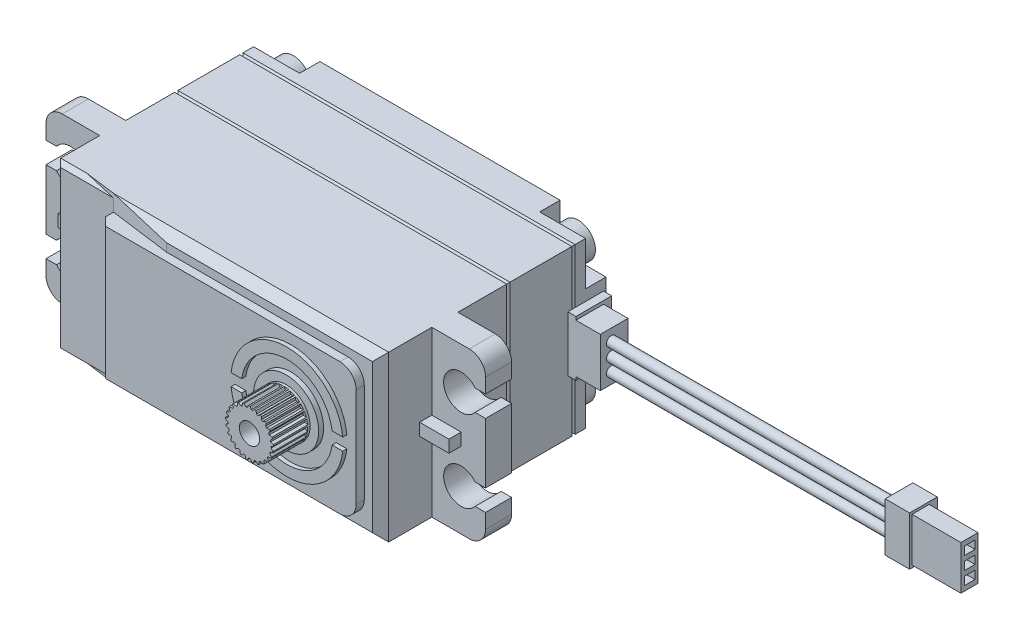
SolidWorks part; units mm, degrees
ref_plane "前视基准面" through (0, 0, 0) normal (0, 0, 1) x (1, 0, 0)
ref_plane "上视基准面" through (0, 0, 0) normal (0, 1, 0) x (1, 0, 0)
ref_plane "右视基准面" through (0, 0, 0) normal (1, 0, 0) x (0, 0, -1)
sketch "草图1" plane through (0, 0, 0) normal (0, 0, 1) x (1, 0, 0)
  line L1 (-20.4, 10.1) -> (20.4, 10.1)
  line L2 (-20.4, 10.1) -> (-20.4, -10.1)
  line L3 (-20.4, -10.1) -> (20.4, -10.1)
  line L4 (20.4, 10.1) -> (20.4, -10.1)
  dimension "D1" = 20.4
  dimension "D2" = 40.8
  dimension "D3" = 10.1
  dimension "D4" = 20.2
extrude "凸台-拉伸1" add sketch "草图1" along normal blind 4
chamfer "倒角1" distance 0.2 angle 45 4 edges at (0, -10.1, 4) (20.4, 0, 4) (-20.4, 0, 4) (0, 10.1, 4)
sketch "草图2" plane through (0, 0, 4) normal (0, 0, 1) x (1, 0, 0)
  line L0 (20.4, 10.1) -> (20.4, -10.1) construction
  line L1 (20.4, -10.1) -> (-20.4, -10.1) construction
  line L2 (-20.4, -10.1) -> (-20.4, 10.1) construction
  line L3 (-20.4, 10.1) -> (20.4, 10.1) construction
  line L16 (20.4, 10.1) -> (20.4, -10.1)
  line L17 (20.4, -10.1) -> (-20.4, -10.1)
  line L18 (-20.4, -10.1) -> (-20.4, 10.1)
  line L19 (-20.4, 10.1) -> (20.4, 10.1)
extrude "凸台-拉伸2" add sketch "草图2" along normal blind 8 separate body
chamfer "倒角5" distance 0.2 angle 45 4 edges at (0, -10.1, 12) (20.4, 0, 12) (-20.4, 0, 12) (0, 10.1, 12)
sketch "草图3" plane through (0, 0, 12) normal (0, 0, 1) x (1, 0, 0)
  line L0 (20.4, 10.1) -> (20.4, -10.1) construction
  line L1 (20.4, -10.1) -> (-20.4, -10.1) construction
  line L2 (-20.4, -10.1) -> (-20.4, 10.1) construction
  line L3 (-20.4, 10.1) -> (20.4, 10.1) construction
  line L24 (20.4, 10.1) -> (20.4, -10.1)
  line L25 (20.4, -10.1) -> (-20.4, -10.1)
  line L26 (-20.4, -10.1) -> (-20.4, 10.1)
  line L27 (-20.4, 10.1) -> (20.4, 10.1)
extrude "凸台-拉伸3" add sketch "草图3" along normal blind 15.7 separate body
chamfer "倒角6" distance 0.2 angle 45 4 edges at (0, 10.1, 12) (20.4, 0, 12) (-20.4, 0, 12) (0, -10.1, 12)
chamfer "倒角3" distance 1 angle 45 4 edges at (20.4, 0, 27.7) (0, -10.1, 27.7) (-20.4, 0, 27.7) (0, 10.1, 27.7)
chamfer "倒角4" distance 0.2 angle 45 4 edges at (0, 10.1, 4) (20.4, 0, 4) (0, -10.1, 4) (-20.4, 0, 4)
sketch "草图4" plane through (0, 0, 27.7) normal (0, 0, 1) x (1, 0, 0)
  line L0 (20.4, 10.1) -> (20.4, -10.1) construction
  circle A0 centre (10.4, 0) radius 6.9
  dimension "D1" = 10
  dimension "D2" = 13.8
extrude "凸台-拉伸4" add sketch "草图4" along normal blind 1.5
sketch "草图5" plane through (0, 0, 29.2) normal (0, 0, 1) x (1, 0, 0)
  circle A0 centre (10.4, 0) radius 4
  dimension "D1" = 8
extrude "凸台-拉伸5" add sketch "草图5" along normal blind 0.1
sketch "草图6" plane through (0, 0, 29.3) normal (0, 0, 1) x (1, 0, 0)
  circle A0 centre (10.4, 0) radius 2.95
  dimension "D1" = 5.9
extrude "凸台-拉伸6" add sketch "草图6" along normal blind 4.5
sketch "草图7" plane through (0, 0, 33.8) normal (0, 0, 1) x (1, 0, 0)
  circle A0 centre (10.4, 0) radius 1.25
  dimension "D1" = 2.5
extrude "切除-拉伸1" cut sketch "草图7" against normal blind 5
sketch "草图8" plane through (0, 0, 33.8) normal (0, 0, 1) x (1, 0, 0)
  line L0 (11.0364, 2.8805) -> (10.8129, 2.6133)
  line L1 (10.3, 2.9483) -> (10.15, 2.6339)
  line L2 (10.4752, 2.949) -> (10.624, 2.6372)
  line L3 (11.7327, 2.6318) -> (11.4498, 2.4286)
  line L4 (11.2062, 2.8377) -> (11.2728, 2.4987)
  line L5 (12.3454, 2.2177) -> (12.0208, 2.0912)
  line L6 (11.8866, 2.548) -> (11.8667, 2.2031)
  line L7 (12.8358, 1.6642) -> (12.4899, 1.6224)
  line L8 (12.4736, 2.0983) -> (12.3686, 1.7691)
  line L9 (13.1731, 1.0062) -> (12.8277, 1.0517)
  line L10 (12.9302, 1.5167) -> (12.7467, 1.224)
  line L11 (13.3362, 0.2849) -> (13.013, 0.4149)
  line L12 (13.2279, 0.8398) -> (12.9773, 0.6019)
  line L13 (13.3148, -0.4542) -> (13.0341, -0.248)
  line L14 (13.3479, 0.1101) -> (13.0461, -0.0579)
  line L15 (13.1103, -1.1648) -> (12.8897, -0.8953)
  line L16 (13.2827, -0.6264) -> (12.9485, -0.7142)
  line L17 (12.7355, -1.8023) -> (12.5888, -1.4863)
  line L18 (13.0364, -1.3237) -> (12.6909, -1.3255)
  line L19 (12.2139, -2.3264) -> (12.1504, -1.9839)
  line L20 (12.6244, -1.9377) -> (12.2892, -1.8536)
  line L21 (11.5783, -2.7045) -> (11.6021, -2.3569)
  line L22 (12.0726, -2.43) -> (11.7689, -2.2652)
  line L23 (10.8687, -2.9125) -> (10.9781, -2.5818)
  line L24 (11.4157, -2.7696) -> (11.1626, -2.5345)
  line L25 (10.1297, -2.9376) -> (10.3179, -2.6445)
  line L26 (10.695, -2.9352) -> (10.5083, -2.6445)
  line L27 (9.4076, -2.7781) -> (9.6628, -2.541)
  line L28 (9.9558, -2.9164) -> (9.8473, -2.5883)
  line L29 (8.7479, -2.444) -> (9.0541, -2.2778)
  line L30 (9.2445, -2.7143) -> (9.2209, -2.3696)
  line L31 (8.192, -1.9564) -> (8.5299, -1.8716)
  line L32 (8.6058, -2.3416) -> (8.6687, -2.0019)
  line L33 (7.7749, -1.3458) -> (8.1232, -1.3477)
  line L34 (8.0798, -1.8219) -> (8.2252, -1.5085)
  line L35 (7.5227, -0.6507) -> (7.8596, -0.7391)
  line L36 (7.6996, -1.1876) -> (7.9184, -0.9202)
  line L37 (7.4512, 0.0853) -> (7.7556, -0.0841)
  line L38 (7.4891, -0.4787) -> (7.7675, -0.2742)
  line L39 (7.5651, 0.816) -> (7.8177, 0.5762)
  line L40 (7.4615, 0.2602) -> (7.7821, 0.3891)
  line L41 (7.8571, 1.4953) -> (8.0422, 1.2002)
  line L42 (7.6185, 0.9828) -> (7.9611, 1.0279)
  line L43 (8.3088, 2.0808) -> (8.4147, 1.7489)
  line L44 (7.9503, 1.6437) -> (8.2933, 1.6022)
  line L45 (8.892, 2.5354) -> (8.912, 2.1877)
  line L46 (8.436, 2.2012) -> (8.758, 2.0758)
  line L47 (9.5699, 2.8308) -> (9.5028, 2.489)
  line L48 (9.0452, 2.6205) -> (9.3258, 2.4189)
  line L49 (9.7394, 2.8751) -> (9.9611, 2.6101)
  circle A0 centre (10.4, 0) radius 2.95 construction
  arc A1 (11.0364, 2.8805) -> (10.4752, 2.949) centre (10.4, 0) ccw
  arc A2 (10.15, 2.6339) -> (9.9611, 2.6101) centre (10.4, -0.1047) ccw
  arc A3 (10.3, 2.9483) -> (9.7394, 2.8751) centre (10.4, 0) ccw
  arc A4 (10.8129, 2.6133) -> (10.624, 2.6372) centre (10.374, -0.1014) ccw
  arc A5 (11.7327, 2.6318) -> (11.2062, 2.8377) centre (10.4, 0) ccw
  arc A6 (11.4498, 2.4286) -> (11.2728, 2.4987) centre (10.3496, -0.0917) ccw
  arc A7 (12.3454, 2.2177) -> (11.8866, 2.548) centre (10.4, 0) ccw
  arc A8 (12.0208, 2.0912) -> (11.8667, 2.2031) centre (10.3283, -0.0763) ccw
  arc A9 (12.8358, 1.6642) -> (12.4736, 2.0983) centre (10.4, 0) ccw
  arc A10 (12.4899, 1.6224) -> (12.3686, 1.7691) centre (10.3116, -0.0561) ccw
  arc A11 (13.1731, 1.0062) -> (12.9302, 1.5167) centre (10.4, 0) ccw
  arc A12 (12.8277, 1.0517) -> (12.7467, 1.224) centre (10.3004, -0.0324) ccw
  arc A13 (13.3362, 0.2849) -> (13.2279, 0.8398) centre (10.4, 0) ccw
  arc A14 (13.013, 0.4149) -> (12.9773, 0.6019) centre (10.2955, -0.0066) ccw
  arc A15 (13.3148, -0.4542) -> (13.3479, 0.1101) centre (10.4, 0) ccw
  arc A16 (13.0341, -0.248) -> (13.0461, -0.0579) centre (10.2972, 0.0196) ccw
  arc A17 (13.1103, -1.1648) -> (13.2827, -0.6264) centre (10.4, 0) ccw
  arc A18 (12.8897, -0.8953) -> (12.9485, -0.7142) centre (10.3053, 0.0446) ccw
  arc A19 (12.7355, -1.8023) -> (13.0364, -1.3237) centre (10.4, 0) ccw
  arc A20 (12.5888, -1.4863) -> (12.6909, -1.3255) centre (10.3193, 0.0667) ccw
  arc A21 (12.2139, -2.3264) -> (12.6244, -1.9377) centre (10.4, 0) ccw
  arc A22 (12.1504, -1.9839) -> (12.2892, -1.8536) centre (10.3385, 0.0847) ccw
  arc A23 (11.5783, -2.7045) -> (12.0726, -2.43) centre (10.4, 0) ccw
  arc A24 (11.6021, -2.3569) -> (11.7689, -2.2652) centre (10.3615, 0.0973) ccw
  arc A25 (10.8687, -2.9125) -> (11.4157, -2.7696) centre (10.4, 0) ccw
  arc A26 (10.9781, -2.5818) -> (11.1626, -2.5345) centre (10.3869, 0.1039) ccw
  arc A27 (10.1297, -2.9376) -> (10.695, -2.9352) centre (10.4, 0) ccw
  arc A28 (10.3179, -2.6445) -> (10.5083, -2.6445) centre (10.4131, 0.1039) ccw
  arc A29 (9.4076, -2.7781) -> (9.9558, -2.9164) centre (10.4, 0) ccw
  arc A30 (9.6628, -2.541) -> (9.8473, -2.5883) centre (10.4385, 0.0973) ccw
  arc A31 (8.7479, -2.444) -> (9.2445, -2.7143) centre (10.4, 0) ccw
  arc A32 (9.0541, -2.2778) -> (9.2209, -2.3696) centre (10.4615, 0.0847) ccw
  arc A33 (8.192, -1.9564) -> (8.6058, -2.3416) centre (10.4, 0) ccw
  arc A34 (8.5299, -1.8716) -> (8.6687, -2.0019) centre (10.4807, 0.0667) ccw
  arc A35 (7.7749, -1.3458) -> (8.0798, -1.8219) centre (10.4, 0) ccw
  arc A36 (8.1232, -1.3477) -> (8.2252, -1.5085) centre (10.4947, 0.0446) ccw
  arc A37 (7.5227, -0.6507) -> (7.6996, -1.1876) centre (10.4, 0) ccw
  arc A38 (7.8596, -0.7391) -> (7.9184, -0.9202) centre (10.5028, 0.0196) ccw
  arc A39 (7.4512, 0.0853) -> (7.4891, -0.4787) centre (10.4, 0) ccw
  arc A40 (7.7556, -0.0841) -> (7.7675, -0.2742) centre (10.5045, -0.0066) ccw
  arc A41 (7.5651, 0.816) -> (7.4615, 0.2602) centre (10.4, 0) ccw
  arc A42 (7.8177, 0.5762) -> (7.7821, 0.3891) centre (10.4996, -0.0324) ccw
  arc A43 (7.8571, 1.4953) -> (7.6185, 0.9828) centre (10.4, 0) ccw
  arc A44 (8.0422, 1.2002) -> (7.9611, 1.0279) centre (10.4884, -0.0561) ccw
  arc A45 (8.3088, 2.0808) -> (7.9503, 1.6437) centre (10.4, 0) ccw
  arc A46 (8.4147, 1.7489) -> (8.2933, 1.6022) centre (10.4717, -0.0763) ccw
  arc A47 (8.892, 2.5354) -> (8.436, 2.2012) centre (10.4, 0) ccw
  arc A48 (8.912, 2.1877) -> (8.758, 2.0758) centre (10.4504, -0.0917) ccw
  arc A49 (9.5699, 2.8308) -> (9.0452, 2.6205) centre (10.4, 0) ccw
  arc A50 (9.5028, 2.489) -> (9.3258, 2.4189) centre (10.426, -0.1014) ccw
  point P147 (10.4, 0)
extrude "切除-拉伸2" cut sketch "草图8" against normal blind 4.2
ref_plane "基准面1" through (0, 0, 18.2) normal (0, 0, 1) x (1, 0, 0)
sketch "草图9" plane through (0, 0, 18.2) normal (0, 0, 1) x (1, 0, 0)
  line L0 (20.4, -10.1) -> (27, -10.1)
  line L1 (-20.4, -10.1) -> (-20.4, 10.1) construction
  line L4 (-27, 10.1) -> (-27, 6.3)
  line L5 (27, -6.3) -> (27, -10.1)
  line L6 (-20.4, 10.1) -> (-27, 10.1)
  line L7 (-20.4, -10.1) -> (-27, -10.1)
  line L8 (27, -6.3) -> (25.7125, -6.3)
  line L9 (27, -3.7) -> (25.7125, -3.7)
  line L10 (-27, -3.7) -> (-25.7125, -3.7)
  line L11 (-27, 3.7) -> (-25.7125, 3.7)
  line L12 (-27, 6.3) -> (-25.7125, 6.3)
  line L13 (-20.4, -10.1) -> (-20.4, 10.1)
  line L14 (-27, 3.7) -> (-27, -3.7)
  line L15 (-27, -6.3) -> (-25.7125, -6.3)
  line L16 (-27, -6.3) -> (-27, -10.1)
  line L18 (27, 3.7) -> (27, -3.7)
  line L19 (27, 3.7) -> (25.7125, 3.7)
  line L20 (27, 6.3) -> (25.7125, 6.3)
  line L21 (27, 10.1) -> (27, 6.3)
  line L22 (20.4, -10.1) -> (20.4, 10.1)
  line L23 (20.4, 10.1) -> (27, 10.1)
  arc A0 (-25.7125, 3.7) -> (-25.7125, 6.3) centre (-24, 5) ccw
  arc A1 (-25.7125, -6.3) -> (-25.7125, -3.7) centre (-24, -5) ccw
  arc A4 (25.7125, -6.3) -> (25.7125, -3.7) centre (24, -5) cw
  arc A5 (25.7125, 3.7) -> (25.7125, 6.3) centre (24, 5) cw
  point P18 (-27, -12.7272)
  point P35 (-27.462, 3.7)
  point P36 (-19.7917, 3.7)
  point P37 (-27.462, 6.3)
  point P38 (-19.7917, 6.3)
  dimension "D1" = 4.3
  dimension "D2" = 4.3
  dimension "D3" = 10
extrude "凸台-拉伸7" add sketch "草图9" along normal blind 3.2
fillet "圆角1" radius 2 4 edges at (27, 10.1, 19.8) (27, -10.1, 19.8) (-27, -10.1, 19.8) (-27, 10.1, 19.8)
sketch "草图10" plane through (0, 0, 27.7) normal (0, 0, 1) x (1, 0, 0)
  line L18 (-18.4, 8.1) -> (-18.4, -8.1)
  line L19 (-18.4, -8.1) -> (18.4, -8.1)
  line L20 (18.4, -8.1) -> (18.4, 8.1)
  line L21 (18.4, 8.1) -> (-18.4, 8.1)
  line L22 (-18.4, 8.1) -> (-18.4, -8.1)
  line L23 (-18.4, -8.1) -> (18.4, -8.1)
  line L24 (18.4, -8.1) -> (18.4, 8.1)
  line L25 (18.4, 8.1) -> (-18.4, 8.1)
  circle A0 centre (10.4, 0) radius 6.9 construction
  circle A1 centre (10.4, 0) radius 6.9
  dimension "D1" = 2
extrude "凸台-拉伸8" add sketch "草图10" along normal blind 1
sketch "草图11" plane through (0, 0, 28.7) normal (0, 0, 1) x (1, 0, 0)
  line L0 (-18.4, -8.1) -> (18.4, -8.1) construction
  line L1 (-18.4, 8.1) -> (-13.4, 8.1)
  line L2 (-18.4, 8.1) -> (-18.4, -8.1)
  line L3 (-18.4, -8.1) -> (-13.4, -8.1)
  line L4 (-13.4, 8.1) -> (-13.4, -8.1)
  dimension "D1" = 5
extrude "切除-拉伸3" cut sketch "草图11" against normal blind 1
fillet "圆角2" radius 2 2 edges at (18.4, 8.1, 28.2) (18.4, -8.1, 28.2)
sketch "草图12" plane through (20.4, 0, 0) normal (1, 0, 0) x (0, 0, -1)
  line L0 (-0.3, 3.4) -> (-4.7, 3.4)
  line L5 (-0.3, -3.4) -> (-4.7, -3.4)
  line L7 (-4.7, 3.4) -> (-4.7, -3.4)
  line L10 (-0.3, 9.9) -> (-0.3, -9.9)
  line L11 (-0.3, 3.4) -> (-0.3, -3.4)
  point P1 (0, 3.4)
  point P2 (-10.5775, 3.4)
  point P6 (0, -3.4)
  point P7 (-10.5775, -3.4)
  dimension "D4" = 3.7
extrude "凸台-拉伸9" add sketch "草图12" along normal blind 1
sketch "草图13" plane through (21.4, 0, 0) normal (1, 0, 0) x (0, 0, -1)
  line L1 (-1.3, 3) -> (-4.7, 3)
  line L2 (-1.3, -3) -> (-4.7, -3)
  line L4 (-4.7, 3.4) -> (-4.7, -3.4) construction
  line L7 (-1.3, -3.4) -> (-1.3, 3.4)
  line L8 (-1.3, -3) -> (-1.3, 3)
  line L9 (-4.7, 3) -> (-4.7, -3)
  point P3 (0, 3)
  point P4 (-6.4222, 3)
  point P5 (0, -3)
  point P6 (-6.4222, -3)
  dimension "D4" = 1
extrude "凸台-拉伸10" add sketch "草图13" along normal blind 3
sketch "草图14" plane through (24.4, 0, 0) normal (1, 0, 0) x (0, 0, -1)
  line L0 (-1.3, 3) -> (-4.7, 3) construction
  circle A0 centre (-3.35, 1.6) radius 0.6
  circle A1 centre (-3.35, 0) radius 0.6
  circle A2 centre (-3.35, -1.6) radius 0.6
  dimension "D1" = 1.2
  dimension "D2" = 1.2
  dimension "D3" = 1.2
  dimension "D4" = 1.4
  dimension "D5" = 1.6
  dimension "D6" = 1.6
extrude "凸台-拉伸11" add sketch "草图14" along normal blind 35
sketch "草图15" plane through (59.4, 0, 0) normal (1, 0, 0) x (0, 0, -1)
  line L0 (-1.3, -3) -> (-1.3, 3) construction
  line L1 (-4.7, 3) -> (-1.3, 3)
  line L2 (-4.7, 3) -> (-4.7, -3)
  line L3 (-4.7, -3) -> (-1.3, -3)
  line L4 (-1.3, 3) -> (-1.3, -3)
  line L5 (-1.3, -3) -> (-1.3, 3) construction
extrude "凸台-拉伸12" add sketch "草图15" along normal blind 3
sketch "草图16" plane through (62.4, 0, 0) normal (1, 0, 0) x (0, 0, -1)
  line L13 (-2.3, 2.7) -> (-4.4, 2.7)
  line L14 (-4.4, -2.7) -> (-4.4, 2.7)
  line L15 (-4.4, -2.7) -> (-2.3, -2.7)
  line L16 (-2.3, -2.7) -> (-2.3, 2.7)
  line L18 (-3.9665, 2.1) -> (-2.6663, 2.1)
  line L19 (-3.9665, 2.1) -> (-3.9665, 1.1)
  line L20 (-3.9665, 1.1) -> (-2.6663, 1.1)
  line L21 (-2.6663, 2.1) -> (-2.6663, 1.1)
  line L22 (-3.9665, 0.5) -> (-2.6663, 0.5)
  line L23 (-3.9665, 0.5) -> (-3.9665, -0.5)
  line L24 (-3.9665, -0.5) -> (-2.6663, -0.5)
  line L25 (-2.6663, 0.5) -> (-2.6663, -0.5)
  line L26 (-3.9665, -1.1) -> (-2.6663, -1.1)
  line L27 (-3.9665, -1.1) -> (-3.9665, -2.1)
  line L28 (-3.9665, -2.1) -> (-2.6663, -2.1)
  line L29 (-2.6663, -1.1) -> (-2.6663, -2.1)
  dimension "D1" = 0.6
  dimension "D2" = 1
  dimension "D3" = 0.6
  dimension "D4" = 1
  dimension "D5" = 0.6
  dimension "D6" = 1
extrude "凸台-拉伸13" add sketch "草图16" along normal blind 6
sketch "草图17" plane through (0, 0, 0) normal (0, 0, -1) x (-1, 0, 0)
  line L0 (-14.75, 7.5) -> (-14.75, 10.1)
  line L1 (-17.5, 4.75) -> (-20.4, 4.75)
  line L2 (-17.5, -4.75) -> (-20.4, -4.75)
  line L3 (-14.75, -7.5) -> (-14.75, -10.1)
  line L4 (17.5, -4.75) -> (20.4, -4.75)
  line L5 (14.75, -7.5) -> (14.75, -10.1)
  line L6 (14.75, 7.5) -> (14.75, 10.1)
  line L7 (17.5, 4.75) -> (20.4, 4.75)
  line L8 (-20.4, 10.1) -> (20.4, 10.1) construction
  line L9 (-20.4, 10.1) -> (-14.75, 10.1)
  line L10 (20.4, -10.1) -> (20.4, 10.1) construction
  line L11 (20.4, -10.1) -> (20.4, -4.75)
  line L12 (-20.4, -10.1) -> (-20.4, 10.1) construction
  line L13 (-20.4, -10.1) -> (-20.4, -4.75)
  line L14 (20.4, -10.1) -> (-20.4, -10.1) construction
  line L15 (20.4, -10.1) -> (14.75, -10.1)
  line L16 (14.75, 10.1) -> (20.4, 10.1)
  line L17 (-20.4, 4.75) -> (-20.4, 10.1)
  line L18 (-14.75, -10.1) -> (-20.4, -10.1)
  line L19 (20.4, 4.75) -> (20.4, 10.1)
  circle A0 centre (-17.5, 7.5) radius 1
  circle A1 centre (-17.5, -7.5) radius 1
  circle A2 centre (17.5, 7.5) radius 1
  circle A3 centre (17.5, -7.5) radius 1
  arc A4 (-17.5, 4.75) -> (-14.75, 7.5) centre (-17.5, 7.5) ccw
  arc A5 (14.75, 7.5) -> (17.5, 4.75) centre (17.5, 7.5) ccw
  arc A6 (17.5, -4.75) -> (14.75, -7.5) centre (17.5, -7.5) ccw
  arc A7 (-14.75, -7.5) -> (-17.5, -4.75) centre (-17.5, -7.5) ccw
  dimension "D2" = 5.5
  dimension "D3" = 5.5
  dimension "D4" = 5.5
  dimension "D5" = 15
  dimension "D6" = 5.5
  dimension "D9" = 2
  dimension "D10" = 2
  dimension "D11" = 2
  dimension "D12" = 2
extrude "切除-拉伸4" cut sketch "草图17" against normal blind 2.5
sketch "草图18" plane through (0, 0, 0) normal (0, 0, -1) x (-1, 0, 0)
  circle A1 centre (-17.5, -7.5) radius 1
  circle A3 centre (-17.5, -7.5) radius 1
  circle A5 centre (-17.5, 7.5) radius 1
  circle A7 centre (-17.5, 7.5) radius 1
  circle A9 centre (17.5, 7.5) radius 1
  circle A10 centre (17.5, 7.5) radius 1
  circle A11 centre (17.5, -7.5) radius 1
  circle A12 centre (17.5, -7.5) radius 1
  dimension "D1" = 0
  dimension "D2" = 0
  dimension "D3" = 0
  dimension "D4" = 0
extrude "切除-拉伸5" cut sketch "草图18" against normal blind 2.5
sketch "草图19" plane through (0, 0, 2.5) normal (0, 0, -1) x (-1, 0, 0)
  line L3 (-17, -7) -> (-15.8229, -7)
  line L4 (-17, -7) -> (-17, -5.8229)
  line L5 (-18, -7) -> (-18, -5.8229)
  line L6 (-18, 7) -> (-18, 5.8229)
  line L7 (-17, 8) -> (-15.8229, 8)
  line L8 (-19.1771, -7) -> (-18, -7)
  line L9 (-17, 7) -> (-17, 5.8229)
  line L10 (-19.1771, -8) -> (-18, -8)
  line L11 (-17, 7) -> (-15.8229, 7)
  line L12 (-18, -9.1771) -> (-18, -8)
  line L13 (-19.1771, 7) -> (-18, 7)
  line L14 (-17, -9.1771) -> (-17, -8)
  line L15 (-19.1771, 8) -> (-18, 8)
  line L16 (-17, 9.1771) -> (-17, 8)
  line L17 (-18, 9.1771) -> (-18, 8)
  line L18 (-17, -8) -> (-15.8229, -8)
  line L19 (17, 8) -> (15.8229, 8)
  line L20 (17, 7) -> (15.8229, 7)
  line L21 (17, 7) -> (17, 5.8229)
  line L22 (18, 7) -> (18, 5.8229)
  line L23 (19.1771, 7) -> (18, 7)
  line L24 (19.1771, 8) -> (18, 8)
  line L25 (18, 9.1771) -> (18, 8)
  line L26 (17, 9.1771) -> (17, 8)
  line L27 (17, -8) -> (15.8229, -8)
  line L28 (17, -9.1771) -> (17, -8)
  line L29 (18, -9.1771) -> (18, -8)
  line L30 (19.1771, -8) -> (18, -8)
  line L31 (19.1771, -7) -> (18, -7)
  line L32 (18, -7) -> (18, -5.8229)
  line L33 (17, -7) -> (17, -5.8229)
  line L34 (17, -7) -> (15.8229, -7)
  circle A0 centre (-17.5, 7.5) radius 2.1
  arc A1 (-18, 5.8229) -> (-17, 5.8229) centre (-17.5, 7.5) ccw
  arc A2 (-19.1771, 8) -> (-19.1771, 7) centre (-17.5, 7.5) ccw
  arc A3 (-17, 9.1771) -> (-18, 9.1771) centre (-17.5, 7.5) ccw
  arc A4 (-15.8229, 7) -> (-15.8229, 8) centre (-17.5, 7.5) ccw
  arc A5 (-18, -5.8229) -> (-17, -5.8229) centre (-17.5, -7.5) cw
  arc A6 (-19.1771, -8) -> (-19.1771, -7) centre (-17.5, -7.5) cw
  arc A7 (-17, -9.1771) -> (-18, -9.1771) centre (-17.5, -7.5) cw
  arc A8 (-15.8229, -7) -> (-15.8229, -8) centre (-17.5, -7.5) cw
  circle A9 centre (-17.5, -7.5) radius 2.1
  arc A10 (15.8229, 7) -> (15.8229, 8) centre (17.5, 7.5) cw
  arc A11 (18, 5.8229) -> (17, 5.8229) centre (17.5, 7.5) cw
  arc A12 (19.1771, 8) -> (19.1771, 7) centre (17.5, 7.5) cw
  arc A13 (17, 9.1771) -> (18, 9.1771) centre (17.5, 7.5) cw
  circle A14 centre (17.5, 7.5) radius 2.1
  arc A15 (17, -9.1771) -> (18, -9.1771) centre (17.5, -7.5) ccw
  arc A16 (19.1771, -8) -> (19.1771, -7) centre (17.5, -7.5) ccw
  arc A17 (18, -5.8229) -> (17, -5.8229) centre (17.5, -7.5) ccw
  arc A18 (15.8229, -7) -> (15.8229, -8) centre (17.5, -7.5) ccw
  circle A19 centre (17.5, -7.5) radius 2.1
  point P9 (-19.6, 7)
  point P10 (-14.75, 7)
  point P11 (-18, 9.6)
  point P12 (-18, 5.4)
  point P13 (-19.6, 8)
  point P14 (-14.75, 8)
  point P15 (-17, 9.6)
  point P16 (-17, 5.4)
  dimension "D1" = 4.2
  dimension "D2" = 3.5
extrude "凸台-拉伸14" add sketch "草图19" along normal blind 2
sketch "草图20" plane through (0, 0, 21.4) normal (0, 0, 1) x (1, 0, 0)
  line L2 (-24, -0.75) -> (-20.4, -0.75)
  line L3 (-24, 0.75) -> (-20.4, 0.75)
  line L4 (-20.4, -10.1) -> (-20.4, 10.1) construction
  line L5 (-20.4, -0.75) -> (-20.4, 0.75)
  line L6 (-24, 0.75) -> (-24, -0.75)
  line L8 (24, 0.75) -> (24, -0.75)
  line L9 (24, -0.75) -> (20.4, -0.75)
  line L10 (20.4, -0.75) -> (20.4, 0.75)
  line L11 (24, 0.75) -> (20.4, 0.75)
  point P0 (-27, 0)
  point P1 (-15.103, 0)
  point P5 (-27, -0.75)
  point P6 (-15.103, -0.75)
  point P7 (-27, 0.75)
  point P8 (-15.103, 0.75)
extrude "凸台-拉伸15" add sketch "草图20" along normal blind 1.5
sketch "草图21" plane through (0, 0, 29.2) normal (0, 0, 1) x (1, 0, 0)
  circle A0 centre (10.4, 0) radius 5.6
  circle A1 centre (10.4, 0) radius 4
  dimension "D1" = 11.2
extrude "切除-拉伸6" cut sketch "草图21" against normal blind 0.5
sketch "草图22" plane through (0, 0, 29.2) normal (0, 0, 1) x (1, 0, 0)
  line L2 (3.5409, -0.75) -> (4.8505, -0.75)
  line L3 (3.5409, 0.75) -> (4.8505, 0.75)
  line L4 (15.9495, -0.75) -> (17.2591, -0.75)
  line L5 (15.9495, 0.75) -> (17.2591, 0.75)
  circle A0 centre (10.4, 0) radius 5.6 construction
  arc A1 (4.8505, 0.75) -> (4.8505, -0.75) centre (10.4, 0) ccw
  circle A2 centre (10.4, 0) radius 6.9 construction
  arc A3 (3.5409, 0.75) -> (3.5409, -0.75) centre (10.4, 0) ccw
  arc A4 (15.9495, -0.75) -> (15.9495, 0.75) centre (10.4, 0) ccw
  arc A5 (17.2591, -0.75) -> (17.2591, 0.75) centre (10.4, 0) ccw
  point P0 (0, 0)
  point P1 (18.4, 0)
  point P5 (0, -0.75)
  point P6 (18.4, -0.75)
  point P7 (0, 0.75)
  point P8 (18.4, 0.75)
extrude "切除-拉伸7" cut sketch "草图22" against normal blind 0.5
sketch "草图23" plane through (0, 0, 27.7) normal (0, 0, 1) x (1, 0, 0)
  line L0 (-13.4, -10.1) -> (-13.4, 10.1)
  line L1 (-20.4, 10.1) -> (20.4, 10.1) construction
  line L2 (-20.4, 10.1) -> (-13.4, 10.1)
  line L3 (-20.4, -10.1) -> (-20.4, 10.1) construction
  line L4 (-20.4, -10.1) -> (-20.4, 10.1)
  line L12 (20.4, -10.1) -> (-20.4, -10.1) construction
  line L13 (-13.4, -10.1) -> (-20.4, -10.1)
extrude "切除-拉伸8" cut sketch "草图23" against normal blind 1
sketch "草图24" plane through (0, -10.1, 0) normal (0, -1, 0) x (1, 0, 0)
  line L0 (-13.4, 26.7) -> (-5.9, 27.7)
  line L2 (-13.4, 27.7) -> (16.4, 27.7) construction
  line L3 (-5.9, 27.7) -> (-13.4, 27.7)
  line L4 (-13.4, 27.7) -> (-13.4, 26.7)
  dimension "D1" = 7.5
extrude "切除-拉伸9" cut sketch "草图24" against normal blind 2
mirror "镜向2" about plane through (0, 0, 0) normal (0, 1, 0) of "切除-拉伸9"
chamfer "倒角7" distance 1 angle 45 1 edges at (-13.4, 0, 28.7)
chamfer "倒角9" distance 0.5 angle 45 3 edges at (-16.9, 10.1, 26.7) (-20.4, 0, 26.7) (-16.9, -10.1, 26.7)
